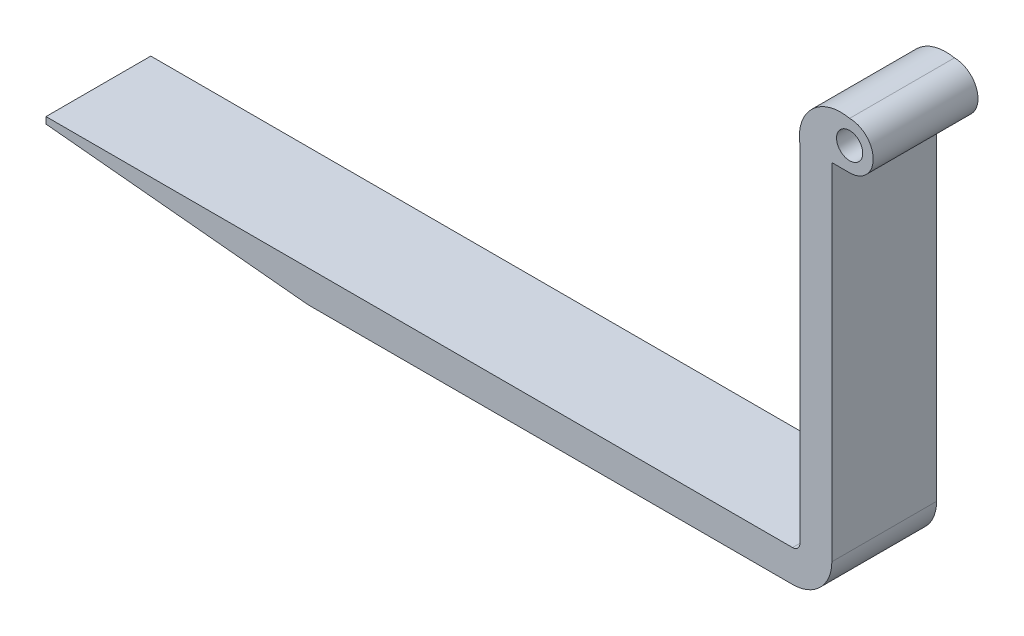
SolidWorks part; units mm, degrees
ref_plane "Front Plane" through (0, 0, 0) normal (0, 0, 1) x (1, 0, 0)
ref_plane "Top Plane" through (0, 0, 0) normal (0, 1, 0) x (1, 0, 0)
ref_plane "Right Plane" through (0, 0, 0) normal (1, 0, 0) x (0, 0, -1)
sketch "Sketch2" plane through (0, 0, 0) normal (0, 0, 1) x (1, 0, 0)
  line L0 (0, 0) -> (0, -660)
  line L1 (-75, -735) -> (-1000, -735)
  line L2 (-61, 0) -> (-61, -660)
  line L3 (-75, -674) -> (-1500, -674)
  line L4 (-61, 0) -> (0, 0)
  line L5 (-1500, -674) -> (-1500, -686.5)
  line L6 (-1500, -686.5) -> (-1000, -735)
  line L8 (-75, -735) -> (-1500, -735) construction
  arc A0 (0, -660) -> (-75, -735) centre (-75, -660) cw
  arc A1 (-61, -660) -> (-75, -674) centre (-75, -660) cw
  point P6 (0, -735)
  dimension "D3" = 75
  dimension "D1" = 735
  dimension "D5" = 12.5
  dimension "D4" = 61
extrude "Boss-Extrude1" add sketch "Sketch2" against normal blind 200
sketch "Sketch3" plane through (0, 0, 0) normal (0, 0, 1) x (1, 0, 0)
  line L0 (0, 0) -> (34, 0)
  line L3 (-61, 0) -> (0, 0)
  arc A0 (34, 0) -> (34, 90) centre (34, 45) ccw
  circle A1 centre (34, 45) radius 25
  arc A2 (-61, 0) -> (34, 90) centre (17.3496, 12.4365) cw
  dimension "D1" = 95
extrude "Boss-Extrude2" add sketch "Sketch3" against normal through all
